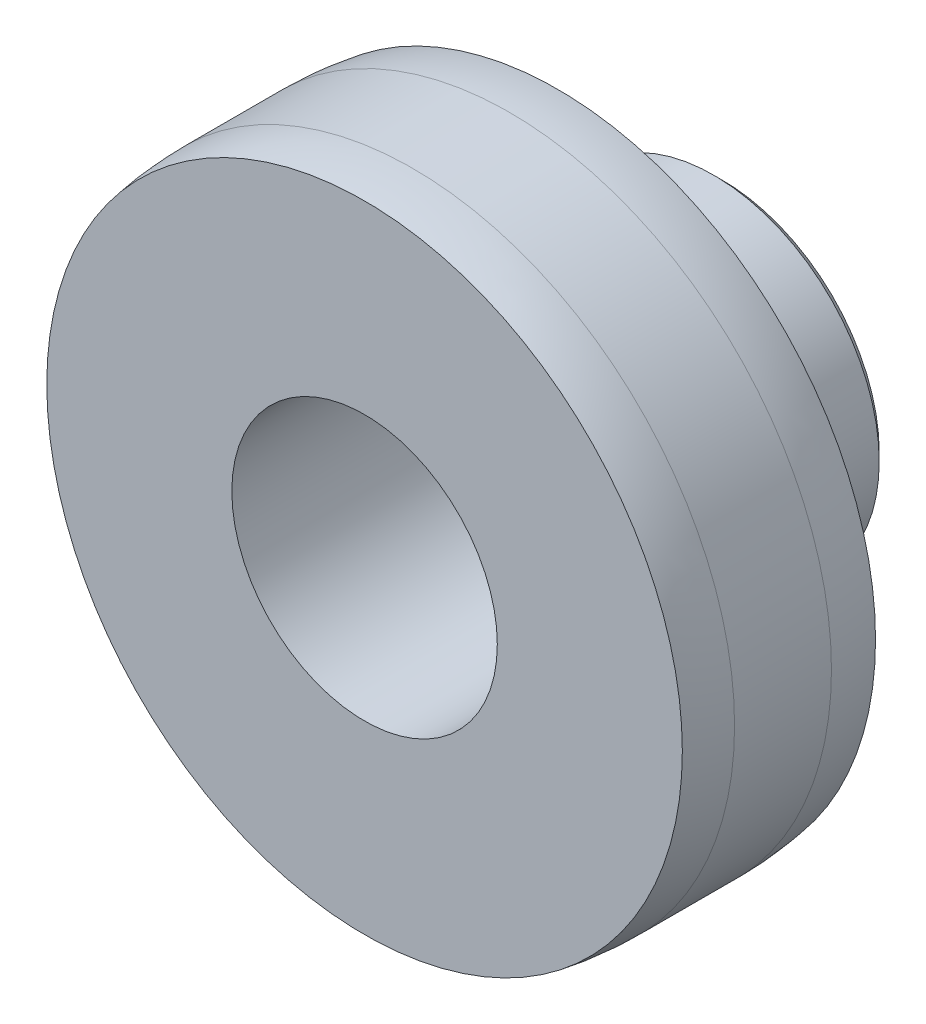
SolidWorks part; units mm, degrees
ref_plane "Front Plane" through (0, 0, 0) normal (0, 0, 1) x (1, 0, 0)
ref_plane "Top Plane" through (0, 0, 0) normal (0, 1, 0) x (1, 0, 0)
ref_plane "Right Plane" through (0, 0, 0) normal (1, 0, 0) x (0, 0, -1)
sketch "Sketch2" plane through (0, 0, 0) normal (1, 0, 0) x (0, 0, -1)
  line L0 (-16.4274, 0) -> (16.4274, 0) construction
  line L1 (0, 19.7612) -> (0, 8.255)
  line L2 (12.0142, 19.7612) -> (12.0142, 10.287)
  line L3 (12.0142, 10.287) -> (22.225, 10.287)
  line L4 (22.225, 10.287) -> (22.225, 8.255)
  line L5 (22.225, 8.255) -> (0, 8.255)
  line L6 (2.9947, 20.0152) -> (9.0195, 20.0152)
  line L7 (6.0071, 20.0152) -> (6.0071, 8.255) construction
  arc A0 (9.0195, 20.0152) -> (12.0142, 19.7612) centre (9.0195, 2.2347) cw
  arc A1 (2.9947, 20.0152) -> (0, 19.7612) centre (2.9947, 2.2347) ccw
  dimension "D1" = 22.225
  dimension "D2" = 12.0142
  dimension "D3" = 6.0249
  dimension "D4" = 0.254
  dimension "D5" = 16.51
  dimension "D6" = 20.574
  dimension "D7" = 40.0304
revolve "Revolve1" add sketch "Sketch2" angle 360 about L0
sketch "Sketch3" plane through (0, 0, 0) normal (1, 0, 0) x (0, 0, -1)
  circle A0 centre (17.3228, 0) radius 2.286
  dimension "D1" = 4.572
  dimension "D2" = 17.3228
extrude "Extrude1" cut sketch "Sketch3" along normal up to surface (10.287 mm away)
sketch "Sketch4" plane through (0, 0, 0) normal (0, 1, 0) x (1, 0, 0)
  circle A0 centre (0, 17.2847) radius 2.286
  dimension "D1" = 4.572
  dimension "D2" = 17.2847
extrude "Extrude2" cut sketch "Sketch4" along normal up to surface (10.287 mm away)
chamfer "Chamfer1" distance 0.508 angle 45
chamfer "Chamfer2" distance 0.0965 angle 45
